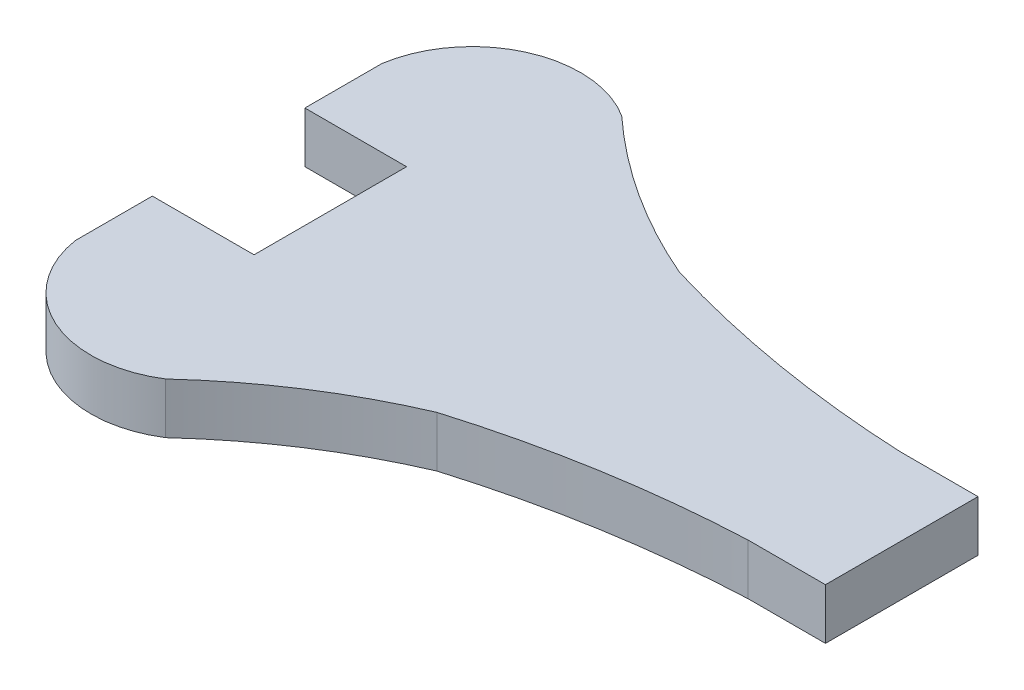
SolidWorks part; units mm, degrees
ref_plane "Alzado" through (0, 0, 0) normal (0, 0, 1) x (1, 0, 0)
ref_plane "Planta" through (0, 0, 0) normal (0, 1, 0) x (1, 0, 0)
ref_plane "Vista lateral" through (0, 0, 0) normal (1, 0, 0) x (0, 0, -1)
sketch "Croquis1" plane through (0, 0, 0) normal (0, 1, 0) x (1, 0, 0)
  line L8 (13846.0506, 3171.6025) -> (13846.0506, 3194.3137)
  line L9 (13846.0506, 3171.6025) -> (13876.0506, 3171.6025)
  line L10 (13876.0506, 3171.6025) -> (13876.0506, 3149.1025)
  line L11 (13846.0506, 3126.6025) -> (13846.0506, 3103.8913)
  line L12 (13846.0506, 3126.6025) -> (13876.0506, 3126.6025)
  line L13 (13876.0506, 3126.6025) -> (13876.0506, 3149.1025)
  line L14 (14044.6105, 3171.6025) -> (14044.6105, 3126.6025)
  line L15 (14021.7508, 3171.6025) -> (14044.6105, 3171.6025)
  line L16 (14021.7508, 3126.6025) -> (14044.6105, 3126.6025)
  arc A6 (13894.7414, 3216.3604) -> (13846.0506, 3194.3137) centre (13877.626, 3189.3693) ccw
  arc A7 (13894.7414, 3216.3604) -> (13943.301, 3184.8783) centre (14010.99, 3342.4766) ccw
  arc A8 (13943.301, 3184.8783) -> (14021.7508, 3171.6025) centre (14036.0375, 3494.4533) ccw
  arc A9 (13846.0506, 3103.8913) -> (13894.7414, 3081.8446) centre (13877.626, 3108.8357) ccw
  arc A10 (13943.301, 3113.3267) -> (13894.7414, 3081.8446) centre (14010.99, 2955.7285) ccw
  arc A11 (14021.7508, 3126.6025) -> (13943.301, 3113.3267) centre (14036.0375, 2803.7517) ccw
  point P23 (0, 0.001)
  point P24 (0.001, 0.001)
  point P25 (0.001, 0)
extrude "Saliente-Extruir1" add sketch "Croquis1" along normal blind 15
